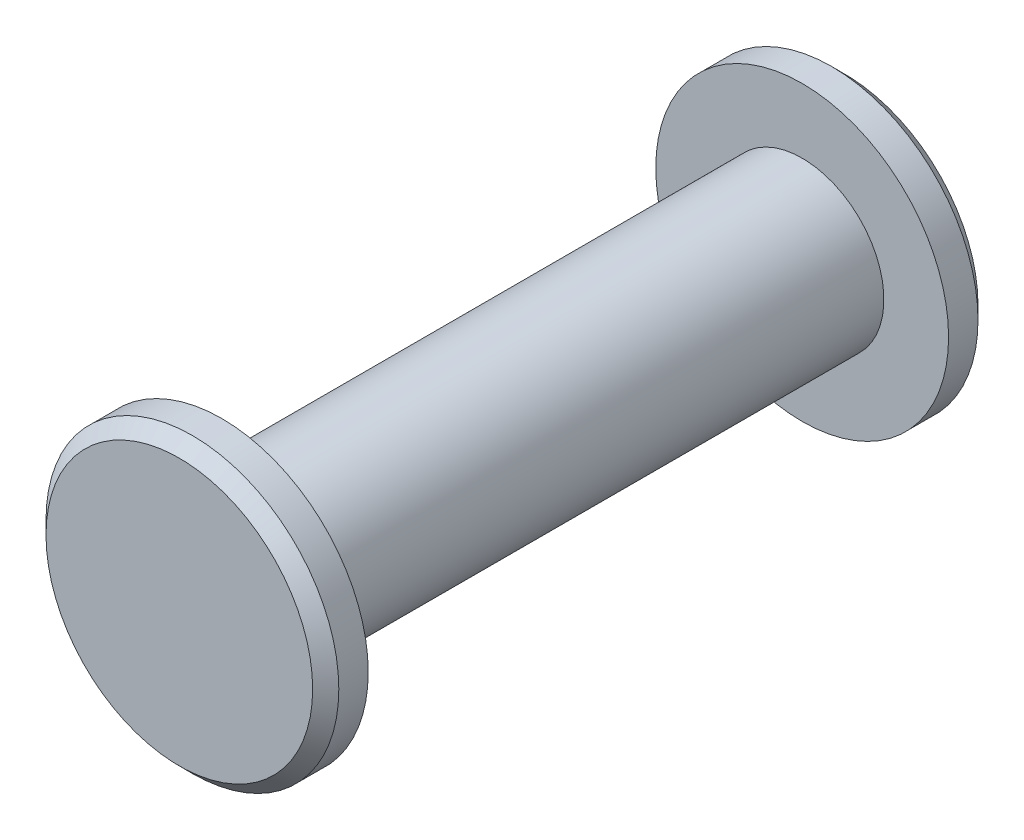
SolidWorks part; units mm, degrees
ref_plane "Front Plane" through (0, 0, 0) normal (0, 0, 1) x (1, 0, 0)
ref_plane "Top Plane" through (0, 0, 0) normal (0, 1, 0) x (1, 0, 0)
ref_plane "Right Plane" through (0, 0, 0) normal (1, 0, 0) x (0, 0, -1)
sketch "Sketch1" plane through (0, 0, 0) normal (0, 0, 1) x (1, 0, 0)
  circle A0 centre (0, 0) radius 1.5875
  dimension "D1" = 3.175
extrude "Boss-Extrude1" add sketch "Sketch1" along normal mid plane 11.2776
sketch "Sketch2" plane through (0, 0, 5.6388) normal (0, 0, 1) x (1, 0, 0)
  circle A0 centre (0, 0) radius 2.8448
  dimension "D1" = 5.6896
extrude "Boss-Extrude2" add sketch "Sketch2" along normal blind 0.8255
sketch "Sketch3" plane through (0, 0, -5.6388) normal (0, 0, -1) x (-1, 0, 0)
  circle A0 centre (0, 0) radius 2.8448
extrude "Boss-Extrude3" add sketch "Sketch3" along normal blind 0.8255
chamfer "Chamfer1" distance 0.254 angle 45 2 edges at (-2.8448, 0, -6.4643) (2.8448, 0, 6.4643)
